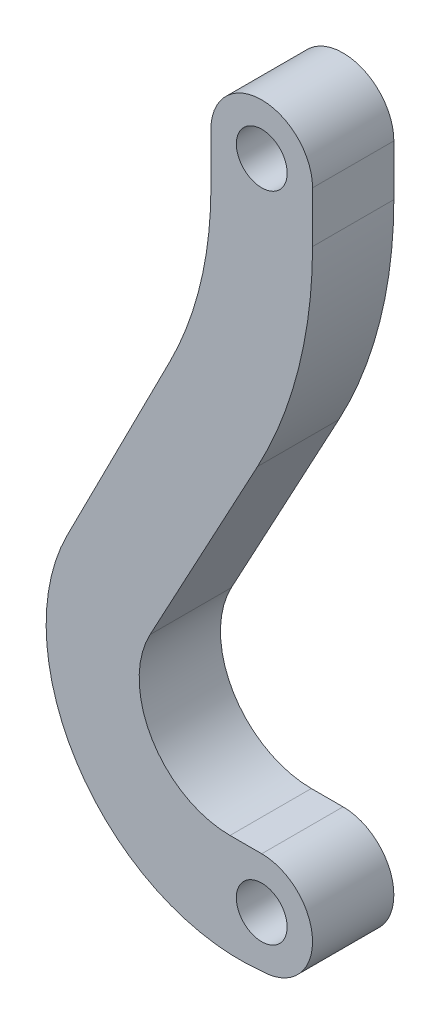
SolidWorks part; units mm, degrees
ref_plane "Front Plane" through (0, 0, 0) normal (0, 0, 1) x (1, 0, 0)
ref_plane "Top Plane" through (0, 0, 0) normal (0, 1, 0) x (1, 0, 0)
ref_plane "Right Plane" through (0, 0, 0) normal (1, 0, 0) x (0, 0, -1)
sketch "Sketch1" plane through (0, 0, 0) normal (0, 0, 1) x (1, 0, 0)
  line L0 (2, 12.85) -> (2, 11.8492)
  line L1 (-0.4989, 0) -> (2.4989, 0) construction
  line L2 (0.9167, 7.5582) -> (-1.1981, 3.6368)
  line L3 (0, 12.85) -> (2, 12.85) construction
  line L4 (0.3757, 1) -> (1, 1)
  line L5 (0, 12.85) -> (0, 11.8492)
  line L6 (-0.8065, 8.4874) -> (-2.8282, 4.516)
  arc A0 (0, 12.85) -> (2, 12.85) centre (1, 12.85) cw
  arc A1 (1, 1) -> (1, -1) centre (1, 0) cw
  circle A2 centre (1, 12.85) radius 0.5
  circle A3 centre (1, 0) radius 0.5
  arc A4 (2, 11.8492) -> (0.9167, 7.5582) centre (-7.0401, 11.8492) cw
  arc A5 (-1.1981, 3.6368) -> (0.3757, 1) centre (0.3757, 2.7881) ccw
  arc A6 (0, 11.8492) -> (-0.8065, 8.4874) centre (-7.4101, 11.8492) cw
  arc A7 (-2.8282, 4.516) -> (1, -1) centre (0.5683, 2.7868) ccw
  dimension "D3" = 2
  dimension "D1" = 2
  dimension "D2" = 12.85
extrude "Extrude1" add sketch "Sketch1" along normal blind 1.6
